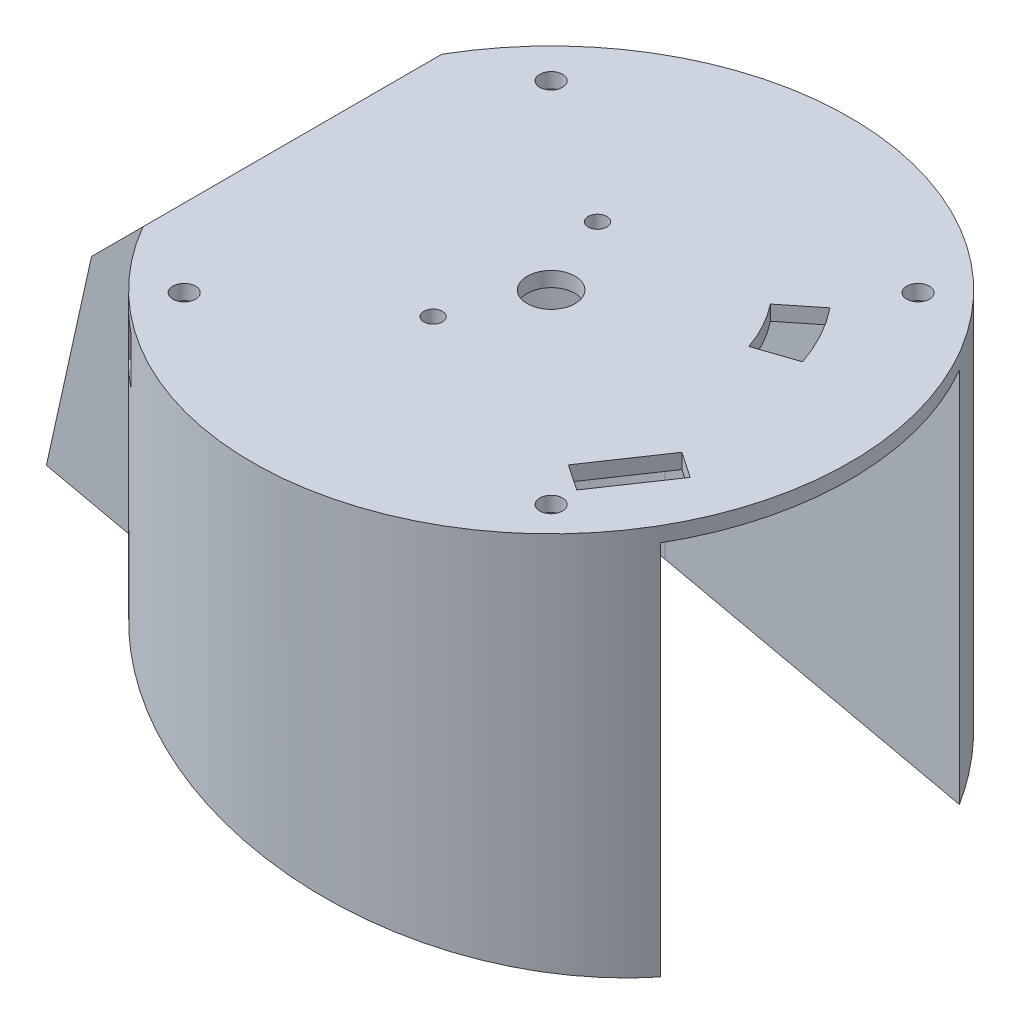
SolidWorks part; units mm, degrees
ref_plane "Front Plane" through (0, 0, 0) normal (0, 0, 1) x (1, 0, 0)
ref_plane "Top Plane" through (0, 0, 0) normal (0, 1, 0) x (1, 0, 0)
ref_plane "Right Plane" through (0, 0, 0) normal (1, 0, 0) x (0, 0, -1)
sketch "Sketch1" plane through (0, 0, 0) normal (0, 1, 0) x (1, 0, 0)
  circle A0 centre (0, 0) radius 5.08
  circle A1 centre (-7.62, -17.4625) radius 1.9685
  circle A2 centre (-7.62, 17.4625) radius 1.9685
  circle A3 centre (0, 0) radius 63.5
  point P0 (0, 0)
  dimension "D3" = 10.16
  dimension "D4" = 3.937
  dimension "D6" = 3.937
  dimension "D5" = 7.62
  dimension "D7" = 17.4625
  dimension "D8" = 34.925
extrude "Boss-Extrude1" add sketch "Sketch1" along normal blind 3.175
sketch "Sketch5" plane through (0, 0, 0) normal (0, -1, 0) x (1, 0, 0)
  circle A0 centre (39.497, -38.481) radius 2.413
  circle A1 centre (-38.481, -38.481) radius 2.413
  circle A2 centre (-38.481, 39.497) radius 2.413
  circle A3 centre (39.497, 39.497) radius 2.413
  dimension "D1" = 4.826
  dimension "D2" = 4.826
  dimension "D3" = 4.826
  dimension "D4" = 4.826
extrude "Cut-Extrude5" cut sketch "Sketch5" against normal up to next
sketch "Sketch4" plane through (0, 0, 0) normal (0, -1, 0) x (1, 0, 0)
  line L0 (32.9325, -26.3297) -> (25.8897, -20.6989)
  line L1 (31.4078, -10.5958) -> (39.9517, -13.4782)
  arc A0 (31.4078, -10.5958) -> (25.8897, -20.6989) centre (0, 0) cw
  arc A2 (32.9325, -26.3297) -> (39.9517, -13.4782) centre (0, 0) ccw
  point P8 (29.0907, -15.8888)
  point P9 (37.0043, -20.211)
  dimension "D1" = 33.147
  dimension "D2" = 42.164
extrude "Cut-Extrude4" cut sketch "Sketch4" against normal up to next
sketch "Sketch6" plane through (0, 0, 0) normal (0, -1, 0) x (1, 0, 0)
  line L0 (-38.481, 39.497) -> (39.497, 39.497) construction
  line L3 (-38.481, -38.481) -> (39.497, -38.481) construction
  line L4 (-7.5335, 31.75) -> (54.9926, 31.75)
  line L5 (-7.5335, -31.75) -> (54.9926, -31.75)
  circle A0 centre (-7.5335, 0) radius 31.75
  circle A1 centre (-38.481, 39.497) radius 2.159
  circle A2 centre (39.497, 39.497) radius 2.159
  circle A3 centre (-38.481, -38.481) radius 2.159
  circle A4 centre (39.497, -38.481) radius 2.159
  circle A5 centre (0, 0) radius 63.5
extrude "Boss-Extrude2" add sketch "Sketch6" along normal blind 81.788
sketch "Sketch8" plane through (-77.9953, -26.5659, -77.474) normal (0, 0, 1) x (1, 0, 0)
  line L0 (141.4953, 26.5659) -> (141.4953, -89.0943) construction
  line L1 (134.6215, -55.2221) -> (141.4953, -55.2221) construction
  line L2 (141.4953, -55.2221) -> (14.4953, -55.2221)
  line L3 (14.4953, -55.2221) -> (14.4953, -27.0668)
  line L4 (14.4953, 29.7409) -> (14.4953, -55.2221) construction
  line L5 (14.4953, -27.0668) -> (141.4953, -55.2221)
  dimension "D1" = 12.5
extrude "Cut-Extrude9" cut sketch "Sketch8" along normal through all
sketch "Sketch10" plane through (0, 3.175, 0) normal (0, 1, 0) x (1, 0, 0)
  line L0 (34.0355, -30.3723) -> (39.5421, -34.1012)
  line L1 (34.0355, -30.3723) -> (43.7737, -15.9915)
  line L2 (39.5421, -34.1012) -> (49.2804, -19.7204)
  line L3 (43.7737, -15.9915) -> (49.2804, -19.7204)
extrude "Cut-Extrude10" cut sketch "Sketch10" against normal blind 12.7
sketch "Sketch11" plane through (0, 0, 0) normal (0, -1, 0) x (1, 0, 0)
  line L0 (35.2442, -38.481) -> (35.2442, -31.75)
  line L1 (35.2442, -38.481) -> (37.3706, -42.164)
  line L2 (37.3706, -42.164) -> (41.6234, -42.164)
  line L3 (41.6234, -42.164) -> (43.7498, -38.481)
  line L4 (43.7498, -38.481) -> (41.6234, -34.798)
  line L5 (41.6234, -34.798) -> (37.3706, -34.798)
  line L6 (37.3706, -34.798) -> (35.2442, -38.481)
  line L7 (-34.2282, -38.481) -> (-36.3546, -34.798)
  line L8 (-36.3546, -34.798) -> (-40.6074, -34.798)
  line L9 (-40.6074, -34.798) -> (-42.7338, -38.481)
  line L10 (-42.7338, -38.481) -> (-40.6074, -42.164)
  line L11 (-40.6074, -42.164) -> (-36.3546, -42.164)
  line L12 (-36.3546, -42.164) -> (-34.2282, -38.481)
  line L13 (-34.2282, 39.497) -> (-36.3546, 43.18)
  line L14 (-36.3546, 43.18) -> (-40.6074, 43.18)
  line L15 (-40.6074, 43.18) -> (-42.7338, 39.497)
  line L16 (-42.7338, 39.497) -> (-40.6074, 35.814)
  line L17 (-40.6074, 35.814) -> (-36.3546, 35.814)
  line L18 (-36.3546, 35.814) -> (-34.2282, 39.497)
  line L19 (43.7498, 39.497) -> (41.6234, 43.18)
  line L20 (41.6234, 43.18) -> (37.3706, 43.18)
  line L21 (37.3706, 43.18) -> (35.2442, 39.497)
  line L22 (35.2442, 39.497) -> (37.3706, 35.814)
  line L23 (37.3706, 35.814) -> (41.6234, 35.814)
  line L24 (41.6234, 35.814) -> (43.7498, 39.497)
  line L25 (-7.5335, -31.75) -> (54.9926, -31.75) construction
  line L26 (35.2442, -31.75) -> (43.7498, -31.75)
  line L27 (43.7498, -31.75) -> (43.7498, -38.481)
  line L28 (35.2442, 39.497) -> (35.2442, 31.75)
  line L29 (-7.5335, 31.75) -> (54.9926, 31.75) construction
  line L30 (35.2442, 31.75) -> (43.7498, 31.75)
  line L31 (43.7498, 31.75) -> (43.7498, 39.497)
  line L32 (-42.7338, 39.497) -> (-45.5022, 44.2922)
  line L33 (-36.3546, 43.18) -> (-39.9307, 49.374)
  line L34 (-42.7338, -38.481) -> (-45.8693, -43.9119)
  line L35 (-36.3546, -42.164) -> (-40.3295, -49.0487)
  circle A0 centre (39.497, -38.481) radius 3.683 construction
  circle A1 centre (-38.481, -38.481) radius 3.683 construction
  circle A2 centre (-38.481, 39.497) radius 3.683 construction
  circle A3 centre (39.497, 39.497) radius 3.683 construction
  arc A4 (54.9926, 31.75) -> (54.9926, -31.75) centre (0, 0) ccw construction
  arc A5 (-40.3295, -49.0487) -> (-45.8693, -43.9119) centre (0, 0) cw
  arc A6 (-39.9307, 49.374) -> (-45.5022, 44.2922) centre (0, 0) ccw
  point P53 (-41.6706, 37.6555)
  point P55 (-35.2914, 41.3385)
  dimension "D1" = 7.366
  dimension "D2" = 7.366
  dimension "D3" = 7.366
  dimension "D4" = 7.366
extrude "Cut-Extrude11" cut sketch "Sketch11" along normal blind 10.16 contours L31 L24 L23 L22 L28 L30 M16 M18 | L23 L24 L19 L20 L21 L22 | L5 L6 L1 L2 L3 L4 | L27 L0 L6 L5 L4 M19 | L11 L12 L7 L8 L9 L10 | A5 L35 L11 L10 L34 | L17 L18 L13 L14 L15 L16 | L33 A6 L32 L15 L14
sketch "Sketch12" plane through (-14.3078, -64.5384, 0) normal (-0.2164, -0.9763, 0) x (0.9763, -0.2164, 0)
  line L1 (-37.9951, -31.75) -> (-62.682, -31.75)
  line L2 (-37.9951, -31.75) -> (-37.9951, 31.75)
  line L3 (-37.9951, 31.75) -> (-62.682, 31.75)
  line L4 (-62.682, -31.75) -> (-62.682, 31.75)
  ellipse E0 centre (-0.6872, 0) end of major axis (-0.6872, 63.5) minor radius 61.9948 construction
  dimension "D1" = 63.5
extrude "Boss-Extrude3" add sketch "Sketch12" against normal up to surface (55.4612 mm away)
chamfer "Chamfer1" distance 8.509 angle 45 3 edges at (-59.2463, 3.175, 31.75) (-59.2463, 3.175, -31.75) (-63.5, 3.175, 0)
sketch "Sketch14" plane through (-61.1962, 13.5669, 0) normal (-0.9763, 0.2164, 0) x (0, 0, 1)
  line L0 (0, -21.8423) -> (0, -66.1054) construction
  line L1 (31.75, -21.8423) -> (-31.75, -21.8423) construction
  line L2 (31.75, -66.1054) -> (-31.75, -66.1054) construction
  line L3 (-19.2239, -66.1054) -> (-19.2239, -21.8423)
  line L4 (-19.2239, -66.1054) -> (19.2239, -66.1054)
  line L5 (-19.2239, -21.8423) -> (19.2239, -21.8423)
  line L6 (19.2239, -66.1054) -> (19.2239, -21.8423)
  line L7 (-19.2239, -66.1054) -> (19.2239, -21.8423) construction
  line L8 (-19.2239, -21.8423) -> (19.2239, -66.1054) construction
  point P7 (0, -43.9739)
extrude "Cut-Extrude12" cut sketch "Sketch14" against normal through all
